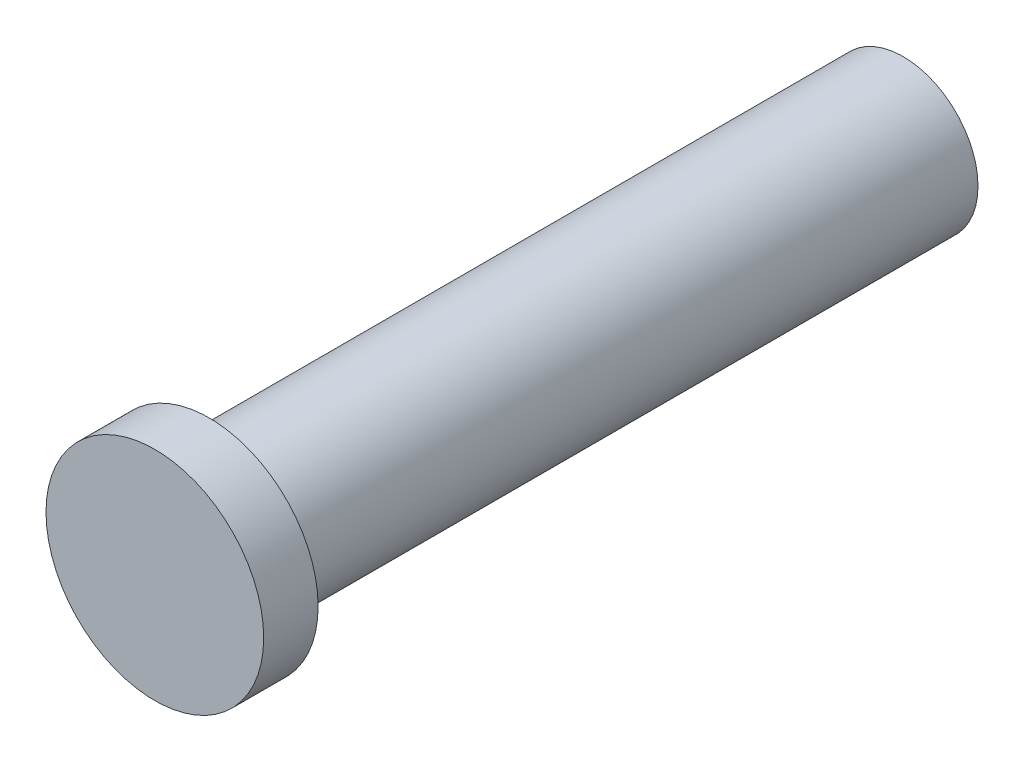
SolidWorks part; units mm, degrees
ref_plane "Plano frontal" through (0, 0, 0) normal (0, 0, 1) x (1, 0, 0)
ref_plane "Plano superior" through (0, 0, 0) normal (0, 1, 0) x (1, 0, 0)
ref_plane "Plano direito" through (0, 0, 0) normal (1, 0, 0) x (0, 0, -1)
sketch "Esboço1" plane through (0, 0, 0) normal (0, 0, 1) x (1, 0, 0)
  circle A0 centre (0, 0) radius 5.5
  dimension "D1" = 11
extrude "Ressalto-extrusão1" add sketch "Esboço1" along normal blind 51
sketch "Esboço2" plane through (0, 0, 51) normal (0, 0, 1) x (1, 0, 0)
  circle A0 centre (0, 0) radius 8
  dimension "D1" = 16
extrude "Ressalto-extrusão2" add sketch "Esboço2" along normal blind 4
hole_wizard "Furo roscado de M51" positions "Esboço3" profile "Esboço4" tap size "M5" standard "ISO"
sketch "Esboço3" plane through (0, 0, 0) normal (0, 0, -1) x (-1, 0, 0)
  point P0 (0, 0)
sketch "Esboço4" plane through (0, 0, 0) normal (1, 0, 0) x (0, 1, 0)
  line L0 (0, 0) -> (0, 15.2618)
  line L1 (0, 15.2618) -> (2.1, 14)
  line L2 (2.1, 14) -> (2.1, 0)
  line L5 (2.1, 0) -> (0, 0)
  line L10 (0, 15.2618) -> (-2.1, 14) construction
  line L11 (0, -6.35) -> (0, 107.95) construction
  dimension "Tap Drill Dia." = 4.2
  dimension "Tap Drill Depth" = 14
  dimension "Drill Angle" = 118
sketch "Esboço5" plane through (0, 0, 0) normal (0, 0, -1) x (-1, 0, 0)
  line L0 (-5.5, 0) -> (5.5, 0) construction
  circle A0 centre (0, 0) radius 5.5 construction
  point P0 (0, 0)
